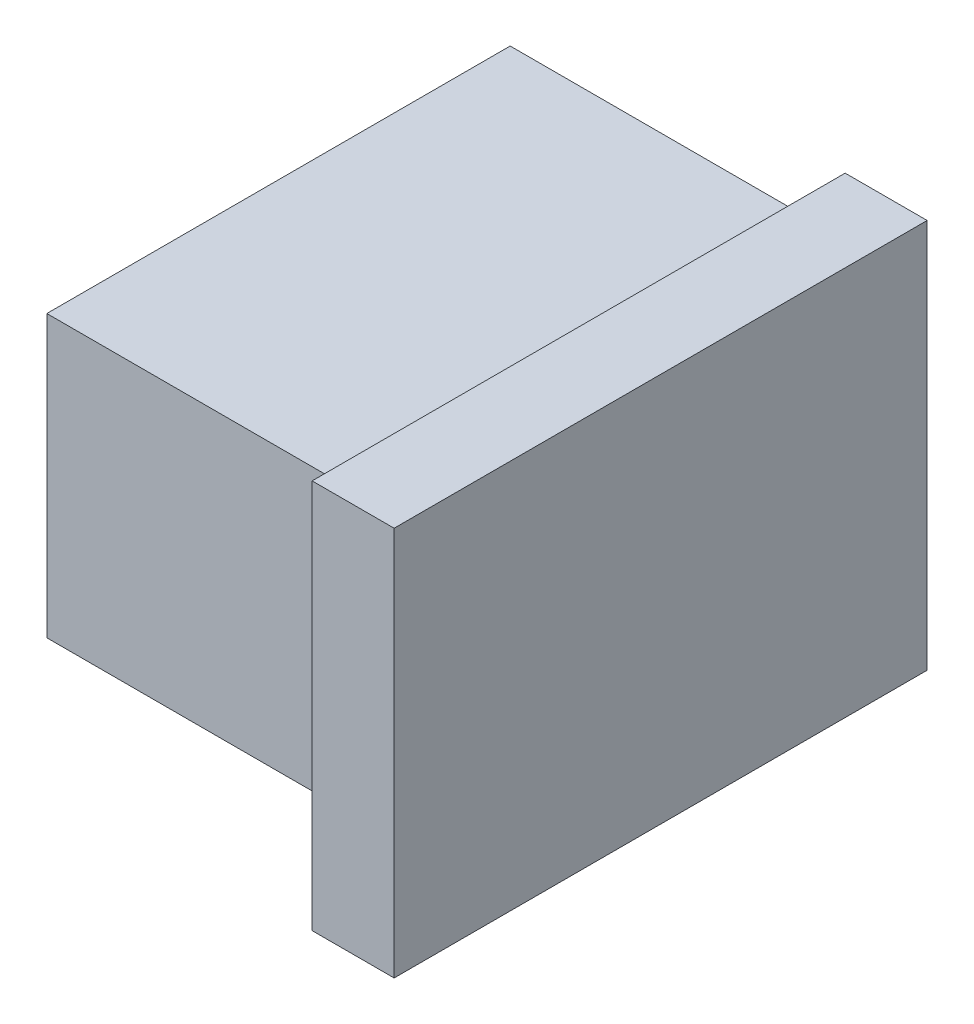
SolidWorks part; units mm, degrees
other "标注1"
sketch "草图1"
ref_plane "Front Plane" through (0, 0, 0) normal (0, 0, 1) x (1, 0, 0)
ref_plane "Top Plane" through (0, 0, 0) normal (0, 1, 0) x (1, 0, 0)
ref_plane "Right Plane" through (0, 0, 0) normal (1, 0, 0) x (0, 0, -1)
sketch "Sketch1" plane through (0, 0, 0) normal (1, 0, 0) x (0, 0, -1)
  line L0 (-1.4133, 0.75) -> (-1.4133, -0.75)
  line L1 (-5.65, 4.2) -> (5.65, -4.2) construction
  line L2 (-5.65, 4.2) -> (5.65, 4.2)
  line L3 (-5.65, 4.2) -> (-5.65, -4.2)
  line L4 (-5.65, -4.2) -> (5.65, -4.2)
  line L5 (5.65, 4.2) -> (5.65, -4.2)
  line L6 (5.65, 4.2) -> (-5.65, -4.2) construction
  circle A0 centre (0, 0) radius 1.6
  point P10 (0, 0)
  dimension "D3" = 3.2
  dimension "D1" = 8.4
  dimension "D2" = 11.3
  dimension "D4" = 1.5
extrude "Boss-Extrude1" add sketch "Sketch1" along normal blind 7.32 contours L5 L2 L3 L4 A0 | L0 A0
sketch "草图2" plane through (7.32, 0, 0) normal (1, 0, 0) x (0, 0, -1)
  line L1 (-6.5, -4.75) -> (6.5, -4.75)
  line L2 (-6.5, -4.75) -> (-6.5, 4.75)
  line L3 (-6.5, 4.75) -> (6.5, 4.75)
  line L4 (6.5, -4.75) -> (6.5, 4.75)
  point P4 (0, 4.75)
  point P6 (-6.5, 0)
  dimension "D1" = 9.5
  dimension "D2" = 13
extrude "凸台-拉伸1" add sketch "草图2" along normal blind 2
sketch "Sketch2" plane through (0, 0, 0) normal (-1, 0, 0) x (0, 0, 1)
  line L0 (5.65, 4.2) -> (5.65, -4.2) construction
  line L1 (-5.65, -4.2) -> (5.65, -4.2)
  line L2 (-5.65, -4.2) -> (-5.65, -2.65)
  line L3 (-5.65, -2.65) -> (5.65, -2.65)
  line L4 (5.65, -4.2) -> (5.65, -2.65)
  dimension "D1" = 1.55
extrude "Cut-Extrude1" cut sketch "Sketch2" against normal up to surface (7.32 mm away)
